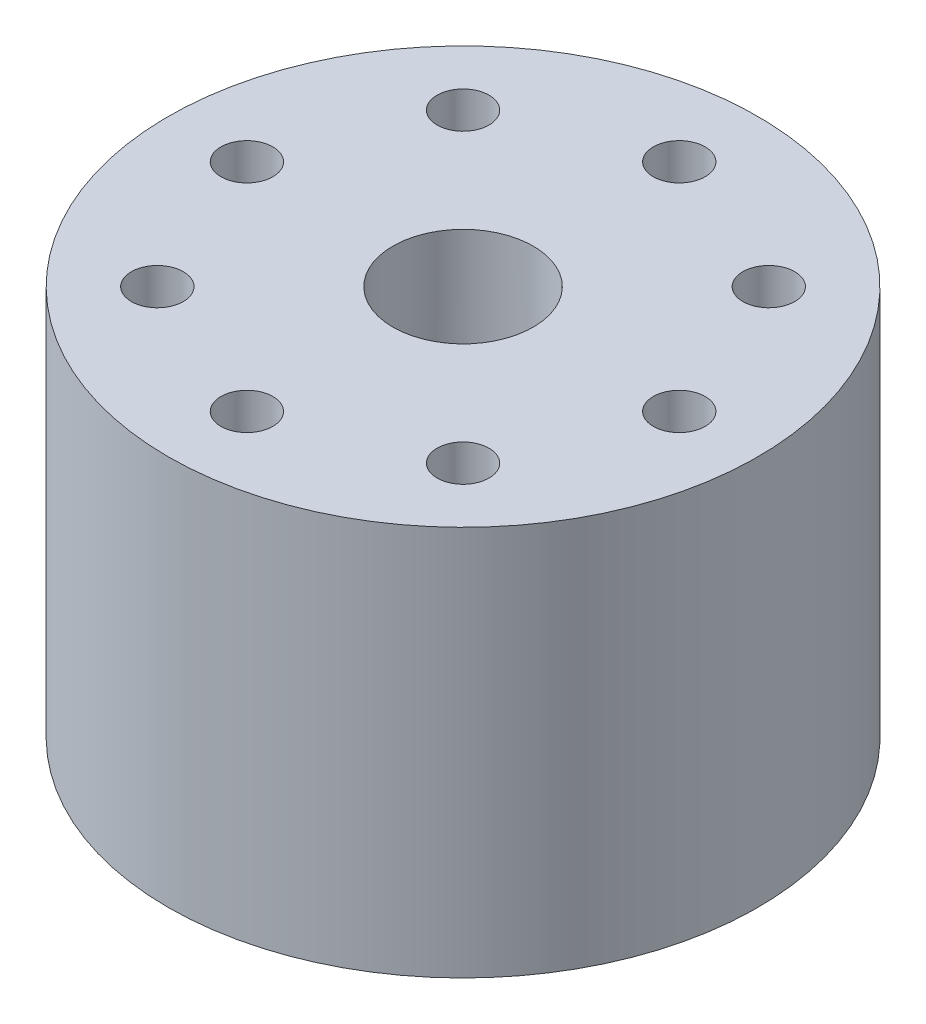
SolidWorks part; units mm, degrees
ref_plane "Front Plane" through (0, 0, 0) normal (0, 0, 1) x (1, 0, 0)
ref_plane "Top Plane" through (0, 0, 0) normal (0, 1, 0) x (1, 0, 0)
ref_plane "Right Plane" through (0, 0, 0) normal (1, 0, 0) x (0, 0, -1)
sketch "Sketch1" plane through (0, 0, 0) normal (0, 1, 0) x (1, 0, 0)
  circle A0 centre (0, 0) radius 37.5
  dimension "D1" = 75
extrude "Outer Cylinder" add sketch "Sketch1" along normal blind 49.65
sketch "Sketch2" plane through (0, 49.65, 0) normal (0, 1, 0) x (1, 0, 0)
  circle A0 centre (0, 0) radius 8.93
  dimension "D1" = 17.86
extrude "NPT Hole" cut sketch "Sketch2" against normal blind 23
sketch "Sketch3" plane through (0, 0, 0) normal (0, -1, 0) x (1, 0, 0)
  circle A0 centre (0, 0) radius 13
  dimension "D1" = 26
extrude "Outer Leaflet Diameter" cut sketch "Sketch3" against normal blind 5
sketch "Sketch4" plane through (0, 0, 0) normal (0, -1, 0) x (1, 0, 0)
  circle A0 centre (0, 0) radius 17
  dimension "D1" = 34
extrude "Depth" cut sketch "Sketch4" against normal blind 3.15
ref_plane "Plane1" through (0, 3.15, 0) normal (0, -1, 0) x (-1, 0, 0)
sketch "Sketch6" plane through (0, 0, 0) normal (0, 0, 1) x (1, 0, 0)
  line L0 (0, 3.15) -> (-13, 3.15)
  line L1 (-17, 3.15) -> (17, 3.15) construction
  line L2 (0, 3.15) -> (0, 21.61)
  line L3 (0, 21.61) -> (-13, 21.61)
  spline S0 degree 2 poles (-13, 21.61) (-20.8, 12.38) (-13, 3.15) knots 0 0 0 1 1 1
revolve "Aortic Root" cut sketch "Sketch6" angle 360 about L2
ref_plane "Plane3" through (0, 26.65, 0) normal (0, 1, 0) x (1, 0, 0)
ref_plane "Plane5" through (0, 21.61, 0) normal (0, -1, 0) x (-1, 0, 0)
sketch "Sketch8" plane through (0, 0, 0) normal (0, 0, 1) x (1, 0, 0)
  line L0 (0, 26.65) -> (0, 21.61)
  line L1 (8.93, 26.65) -> (-8.93, 26.65) construction
  line L2 (-13, 21.61) -> (13, 21.61) construction
  line L3 (0, 21.61) -> (-13, 21.61)
  line L4 (-13, 21.61) -> (-13, 26.65)
  line L5 (-13, 26.65) -> (0, 26.65)
revolve "Ascending Aorta" cut sketch "Sketch8" angle 360 about L0
sketch "Sketch9" plane through (0, 49.65, 0) normal (0, 1, 0) x (1, 0, 0)
  line L0 (0, 0) -> (0, -27.5) construction
  line L1 (0, 0) -> (-19.4454, -19.4454) construction
  circle A0 centre (0, -27.5) radius 3.3
  circle A1 centre (0, 0) radius 27.5
  circle A2 centre (-19.4454, -19.4454) radius 3.3
  circle A3 centre (-27.5, 0) radius 3.3
  circle A4 centre (-19.4454, 19.4454) radius 3.3
  circle A5 centre (0, 27.5) radius 3.3
  circle A6 centre (19.4454, 19.4454) radius 3.3
  circle A7 centre (27.5, 0) radius 3.3
  circle A8 centre (19.4454, -19.4454) radius 3.3
  dimension "D1" = 6.6
  dimension "D3" = 55
  dimension "D2" = 27.5
  dimension "D5" = 45
  dimension "D4" = 8
extrude "Bolt Holes" cut sketch "Sketch9" against normal through all contours A1 A8 | A1 A7 | A1 A6 | A1 A6 | A1 A5 | A1 A5 | A1 A4 | A1 A4 | A1 A3 | A1 A3 | A1 A2 | A1 A2 | A0 A1 | A1 A0 | A1 A8
chamfer "Chamfer3" distance 4 angle 50 1 edges at (0, 26.65, 8.93)
equation "\"A\"= 26"
equation "\"Outer Leaflet Diameter\"= \"A\""
equation "\"Aortic Root Height\"= .71 * \"A\""
equation "\"D2@Sketch6\"=\"A\"/2"
equation "\"D3@Sketch6\"= \"A\" / 2"
equation "\"Max Diameter Height\"= \"A\" * ( .71 / 2 )"
equation "\"Max Diameter\"= \"A\" * ( .65 )"
equation "\"D2@Sketch8\"=\"A\"/2"
